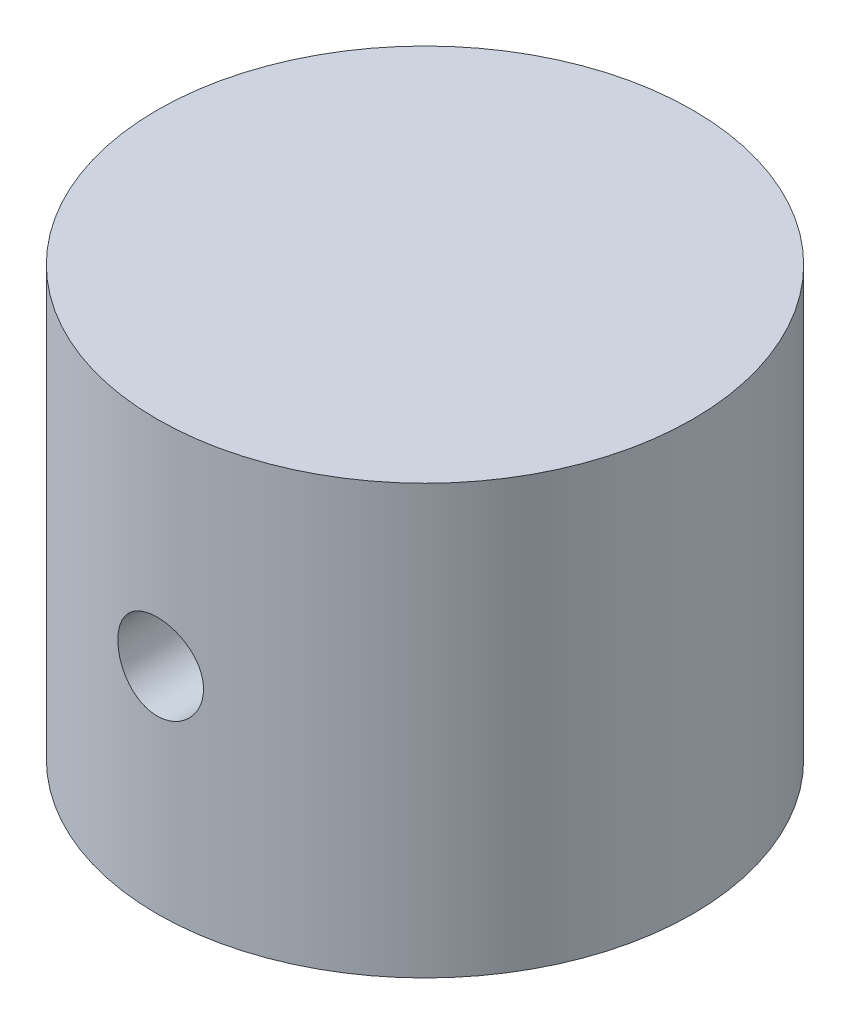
SolidWorks part; units mm, degrees
ref_plane "Front" through (0, 0, 0) normal (0, 0, 1) x (1, 0, 0)
ref_plane "Top" through (0, 0, 0) normal (0, 1, 0) x (1, 0, 0)
ref_plane "Right" through (0, 0, 0) normal (1, 0, 0) x (0, 0, -1)
sketch "Sketch1" plane through (0, 0, 0) normal (0, 0, 1) x (1, 0, 0)
  line L1 (6, -10) -> (12.5, -10)
  line L2 (12.5, -10) -> (12.5, 10)
  line L3 (12.5, 10) -> (0, 10)
  line L4 (0, 10) -> (0, 8)
  line L5 (6, 4.5359) -> (6, -10)
  line L7 (0, 8) -> (6, 4.5359)
revolve "Revolve1" add sketch "Sketch1" angle 360 about L4
sketch "Sketch2" plane through (0, 0, 0) normal (0, 0, 1) x (1, 0, 0)
  circle A0 centre (0, 0) radius 2
extrude "Cut-Extrude1" cut sketch "Sketch2" against normal through all and the other way through all
